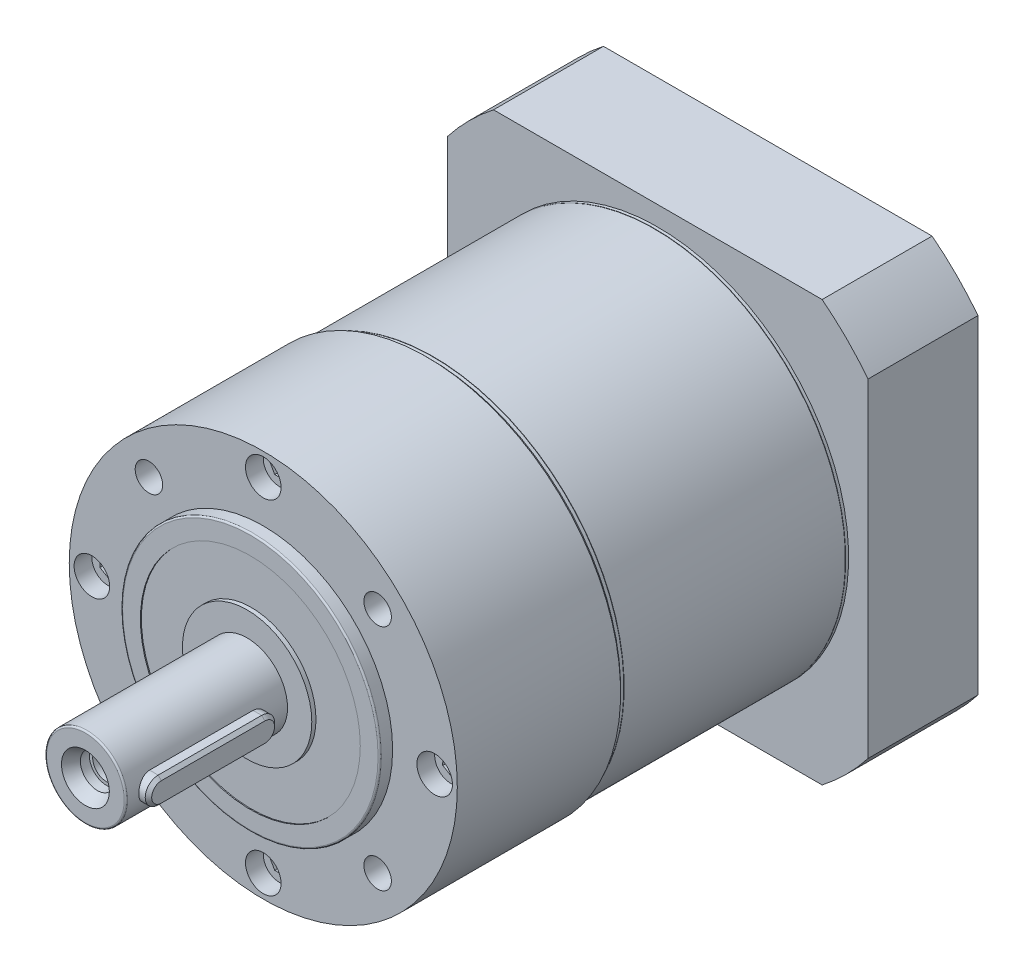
SolidWorks part; units mm, degrees
ref_plane "前视基准面" through (0, 0, 0) normal (0, 0, 1) x (1, 0, 0)
ref_plane "上视基准面" through (0, 0, 0) normal (0, 1, 0) x (1, 0, 0)
ref_plane "右视基准面" through (0, 0, 0) normal (1, 0, 0) x (0, 0, -1)
sketch "草图1" plane through (0, 0, 0) normal (0, 0, 1) x (1, 0, 0)
  circle A0 centre (0, 0) radius 60
extrude "凸台-拉伸1" add sketch "草图1" along normal blind 56.5
sketch "草图2" plane through (0, 0, 56.5) normal (0, 0, 1) x (1, 0, 0)
  circle A0 centre (0, 0) radius 40
extrude "切除-拉伸1" cut sketch "草图2" against normal blind 4 flip side to cut
sketch "草图3" plane through (0, 0, 0) normal (0, 0, -1) x (-1, 0, 0)
  circle A0 centre (0, 0) radius 59
extrude "切除-拉伸2" cut sketch "草图3" against normal blind 1 flip side to cut
chamfer "倒角1" distance 1 angle 45 1 edges at (-60, 0, 1)
ref_plane "基准面1" through (0, 0, -0.1) normal (0, 0, -1) x (-1, 0, 0)
sketch "草图4" plane through (0, 0, -0.1) normal (0, 0, -1) x (-1, 0, 0)
  circle A0 centre (0, 0) radius 59
extrude "凸台-拉伸2" add sketch "草图4" along normal blind 68.4 separate body
ref_plane "基准面2" through (0, 0, -68.6) normal (0, 0, -1) x (-1, 0, 0)
sketch "草图5" plane through (0, 0, -68.6) normal (0, 0, -1) x (-1, 0, 0)
  circle A0 centre (0, 0) radius 59
extrude "凸台-拉伸3" add sketch "草图5" along normal blind 0.9 separate body
sketch "草图6" plane through (0, 0, -69.5) normal (0, 0, -1) x (-1, 0, 0)
  line L1 (-50.806, 65) -> (50.806, 65)
  line L2 (-65, 50.806) -> (-65, -50.806)
  line L3 (-50.806, -65) -> (50.806, -65)
  line L4 (65, 50.806) -> (65, -50.806)
  arc A0 (-50.806, 65) -> (-65, 50.806) centre (0, 0) ccw
  arc A1 (-65, -50.806) -> (-50.806, -65) centre (0, 0) ccw
  arc A2 (50.806, -65) -> (65, -50.806) centre (0, 0) ccw
  arc A3 (65, 50.806) -> (50.806, 65) centre (0, 0) ccw
  dimension "D1" = 65
  dimension "D3" = 65
extrude "凸台-拉伸4" add sketch "草图6" along normal blind 34
sketch "草图7" plane through (0, 0, -103.5) normal (0, 0, -1) x (-1, 0, 0)
  circle A0 centre (0, 0) radius 55
extrude "切除-拉伸3" cut sketch "草图7" against normal blind 8
sketch "草图8" plane through (0, 0, -95.5) normal (0, 0, -1) x (-1, 0, 0)
  circle A0 centre (0, 0) radius 39
extrude "切除-拉伸4" cut sketch "草图8" against normal blind 30
sketch "草图9" plane through (0, 0, -103.5) normal (0, 0, -1) x (-1, 0, 0)
  line L0 (0, 0) -> (-53.5, 0) construction
  circle A0 centre (0, 0) radius 53.5 construction
  circle A1 centre (-53.5, 0) radius 5.5
extrude "切除-拉伸5" cut sketch "草图9" against normal blind 18
pattern_circular "阵列(圆周)1" count 6 over 360 about axis through (0, 0, 0) along (0, 0, 1) of "切除-拉伸5"
sketch "草图10" plane through (0, 0, -103.5) normal (0, 0, -1) x (-1, 0, 0)
  line L0 (0, 0) -> (-51.2652, 51.2652)
  circle A0 centre (0, 0) radius 72.5
hole_wizard "M8 螺纹孔1" positions "3D草图1" profile "草图11" tap size "M8" standard "GB"
sketch3d "3D草图1"
  point P0 (51.2652, 51.2652, -103.5)
sketch "草图11" plane through (51.2652, 51.2652, -103.5) normal (1, 0, 0) x (0, 1, 0)
  line L0 (0, 0) -> (0, 32.0429)
  line L1 (0, 32.0429) -> (3.4, 30)
  line L2 (3.4, 30) -> (3.4, 0)
  line L5 (3.4, 0) -> (0, 0)
  line L10 (0, 32.0429) -> (-3.4, 30) construction
  line L11 (0, -6.35) -> (0, 107.95) construction
  dimension "螺纹孔钻头直径" = 6.8
  dimension "螺纹孔钻头深度" = 30
  dimension "导头角度" = 118
pattern_circular "阵列(圆周)2" count 4 over 360 about axis through (0, 0, 0) along (0, 0, 1) of "M8 螺纹孔1"
fillet "圆角1" radius 0.5 1 edges at (40, 0, 56.5)
sketch "草图12" plane through (0, 0, 56.5) normal (0, 0, 1) x (1, 0, 0)
  circle A0 centre (0, 0) radius 20
extrude "凸台-拉伸5" add sketch "草图12" along normal blind 1
sketch "草图13" plane through (0, 0, 57.5) normal (0, 0, 1) x (1, 0, 0)
  circle A0 centre (0, 0) radius 12.5
extrude "凸台-拉伸6" add sketch "草图13" along normal blind 50
fillet "圆角2" radius 0.5 1 edges at (12.5, 0, 107.5)
sketch "草图14" plane through (0, 0, 52.5) normal (0, 0, 1) x (1, 0, 0)
  line L0 (0, 0) -> (0, -53) construction
  circle A0 centre (0, 0) radius 53 construction
  circle A1 centre (0, -53) radius 5.5
extrude "切除-拉伸6" cut sketch "草图14" against normal blind 11
pattern_circular "阵列(圆周)3" count 4 over 360 about axis through (0, 0, 0) along (0, 0, 1) of "切除-拉伸6"
sketch "草图15" plane through (0, 0, 41.5) normal (0, 0, 1) x (1, 0, 0)
  line L1 (1.4595, -50.5094) -> (-1.4271, -50.4907)
  line L2 (-1.4271, -50.4907) -> (-2.8867, -52.9813)
  line L3 (-2.8867, -52.9813) -> (-1.4595, -55.4906)
  line L4 (-1.4595, -55.4906) -> (1.4271, -55.5093)
  line L5 (1.4271, -55.5093) -> (2.8867, -53.0187)
  line L6 (2.8867, -53.0187) -> (1.4595, -50.5094)
  circle A0 centre (0, -53) radius 5
  circle A1 centre (0, -53) radius 2.5 construction
  dimension "D1" = 5
extrude "凸台-拉伸7" add sketch "草图15" along normal blind 6
pattern_circular "阵列(圆周)4" count 4 over 360 about axis through (0, 0, 0) along (0, 0, 1) of "凸台-拉伸7"
sketch "草图16" plane through (0, 0, -85.5) normal (0, 0, -1) x (-1, 0, 0)
  line L1 (-51.8653, 2.3793) -> (-54.7432, 2.6053)
  line L2 (-54.7432, 2.6053) -> (-56.3779, 0.226)
  line L3 (-56.3779, 0.226) -> (-55.1347, -2.3793)
  line L4 (-55.1347, -2.3793) -> (-52.2568, -2.6053)
  line L5 (-52.2568, -2.6053) -> (-50.6221, -0.226)
  line L6 (-50.6221, -0.226) -> (-51.8653, 2.3793)
  circle A0 centre (-53.5, 0) radius 5
  circle A1 centre (-53.5, 0) radius 2.5 construction
  dimension "D1" = 5
extrude "凸台-拉伸8" add sketch "草图16" along normal blind 6
pattern_circular "阵列(圆周)5" count 6 over 360 about axis through (0, 0, 0) along (0, 0, 1) of "凸台-拉伸8"
ref_plane "基准面3" through (0, 0, -88.5) normal (0, 0, -1) x (-1, 0, 0)
sketch "草图17" plane through (0, 0, -88.5) normal (0, 0, -1) x (-1, 0, 0)
  circle A0 centre (0, 0) radius 32.5
extrude "凸台-拉伸9" add sketch "草图17" against normal up to surface (23 mm away)
chamfer "倒角2" distance 1 angle 45 1 edges at (-32.5, 0, -88.5)
sketch "草图18" plane through (0, 0, -88.5) normal (0, 0, -1) x (-1, 0, 0)
  line L1 (-35.6857, 0.5) -> (35.4718, 0.5)
  line L2 (-35.6857, 0.5) -> (-35.6857, -0.5)
  line L3 (-35.6857, -0.5) -> (35.4718, -0.5)
  line L4 (35.4718, 0.5) -> (35.4718, -0.5)
  dimension "D1" = 0.5
  dimension "D2" = 1
extrude "切除-拉伸7" cut sketch "草图18" against normal up to surface (23 mm away)
sketch "草图19" plane through (0, 0, -103.5) normal (0, 0, -1) x (-1, 0, 0)
  circle A0 centre (0, 0) radius 11
extrude "切除-拉伸8" cut sketch "草图19" against normal blind 59
sketch "草图20" plane through (0, 0, 52.5) normal (0, 0, 1) x (1, 0, 0)
  line L0 (0, 0) -> (-35.3553, 35.3553)
  line L1 (0, 0) -> (0, 53)
  circle A0 centre (0, 0) radius 50
  dimension "D1" = 45
hole_wizard "M10 螺纹孔1" positions "3D草图2" profile "草图21" tap size "M10" standard "GB"
sketch3d "3D草图2"
  point P0 (-35.3553, 35.3553, 52.5)
sketch "草图21" plane through (-35.3553, 35.3553, 52.5) normal (1, 0, 0) x (0, -1, 0)
  line L0 (0, 0) -> (0, 30.0537)
  line L1 (0, 30.0537) -> (4.25, 27.5)
  line L2 (4.25, 27.5) -> (4.25, 0)
  line L5 (4.25, 0) -> (0, 0)
  line L10 (0, 30.0537) -> (-4.25, 27.5) construction
  line L11 (0, -6.35) -> (0, 107.95) construction
  dimension "螺纹孔钻头直径" = 8.5
  dimension "螺纹孔钻头深度" = 27.5
  dimension "导头角度" = 118
pattern_circular "阵列(圆周)6" count 4 over 360 about axis through (0, 0, 0) along (0, 0, 1) of "M10 螺纹孔1"
sketch "草图22" plane through (0, 0, 0) normal (1, 0, 0) x (0, 0, -1)
  line L0 (-107.5, 12) -> (-107.5, -12) construction
  line L1 (-99.5, 4) -> (-67.5, 4)
  line L2 (-99.5, -4) -> (-67.5, -4)
  arc A0 (-99.5, 4) -> (-99.5, -4) centre (-99.5, 0) ccw
  arc A1 (-67.5, -4) -> (-67.5, 4) centre (-67.5, 0) ccw
  dimension "D1" = 8
  dimension "D2" = 32
extrude "凸台-拉伸10" add sketch "草图22" along normal blind 15.5
chamfer "倒角3" distance 1 angle 45 4 edges at (15.5, 4, 83.5) (15.5, 0, 103.5) (15.5, 0, 63.5) (15.5, -4, 83.5)
sketch "草图23" plane through (0, 0, 107.5) normal (0, 0, 1) x (1, 0, 0)
  circle A0 centre (0, 0) radius 5.25
extrude "切除-拉伸9" cut sketch "草图23" against normal blind 6.5
sketch "草图24" plane through (0, 0, 107.5) normal (0, 0, 1) x (1, 0, 0)
  circle A0 centre (0, 0) radius 7.4
ref_plane "基准面4" through (0, 0, 103.8) normal (0, 0, 1) x (1, 0, 0)
sketch "草图25" plane through (0, 0, 103.8) normal (0, 0, 1) x (1, 0, 0)
  circle A0 centre (0, 0) radius 5.25 construction
  circle A1 centre (0, 0) radius 5.25
loft "切除-放样1" cut profiles "草图25", "草图24"
hole_wizard "M10 螺纹孔2" positions "3D草图3" profile "草图26" tap size "M10" standard "GB"
sketch3d "3D草图3"
  line L0 (0, 0, 101) -> (0, 0, 103.8) construction
  point P0 (0, 0, 101)
sketch "草图26" plane through (0, 0, 101) normal (1, 0, 0) x (0, -1, 0)
  line L0 (0, 0) -> (0, 22.5537)
  line L1 (0, 22.5537) -> (4.25, 20)
  line L2 (4.25, 20) -> (4.25, 0)
  line L5 (4.25, 0) -> (0, 0)
  line L10 (0, 22.5537) -> (-4.25, 20) construction
  line L11 (0, -6.35) -> (0, 107.95) construction
  dimension "螺纹孔钻头直径" = 8.5
  dimension "螺纹孔钻头深度" = 20
  dimension "导头角度" = 118
sketch "草图27" plane through (0, 0, 56.5) normal (0, 0, 1) x (1, 0, 0)
  circle A0 centre (0, 0) radius 34
  circle A1 centre (0, 0) radius 20
extrude "切除-拉伸10" cut sketch "草图27" against normal blind 0.3
